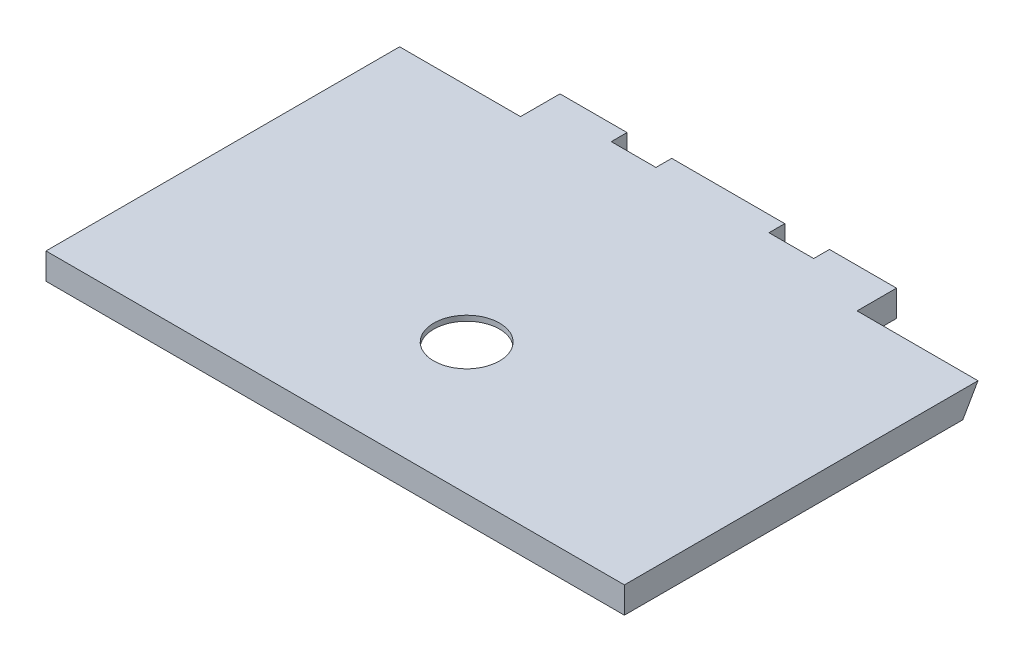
SolidWorks part; units mm, degrees
ref_plane "Front Plane" through (0, 0, 0) normal (0, 0, 1) x (1, 0, 0)
ref_plane "Top Plane" through (0, 0, 0) normal (0, 1, 0) x (1, 0, 0)
ref_plane "Right Plane" through (0, 0, 0) normal (1, 0, 0) x (0, 0, -1)
sketch "Sketch1" plane through (0, 0, 0) normal (0, 1, 0) x (1, 0, 0)
  line L0 (64, 99.5) -> (64, 84.5)
  line L1 (64, 84.5) -> (110, 84.5)
  line L2 (110, 84.5) -> (110, -50)
  line L3 (-64, 99.5) -> (64, 99.5)
  line L4 (110, -50) -> (-110, -50)
  line L5 (-110, -50) -> (-110, 84.5)
  line L6 (-110, 84.5) -> (-64, 84.5)
  line L7 (-64, 84.5) -> (-64, 99.5)
  circle A0 centre (0, 0) radius 12.5
  dimension "D1" = 25
  dimension "D2" = 110
  dimension "D4" = 110
  dimension "D6" = 99.5
  dimension "D3" = 128
  dimension "D5" = 15
  dimension "D7" = 149.5
extrude "Boss-Extrude1" add sketch "Sketch1" against normal blind 10
sketch "Sketch3" plane through (0, 0, 0) normal (0, 1, 0) x (1, 0, 0)
  line L0 (64, 99.5) -> (-64, 99.5) construction
  line L1 (-38.5, 99.5) -> (-21.5, 99.5)
  line L2 (-38.5, 99.5) -> (-38.5, 93.5)
  line L3 (-38.5, 93.5) -> (-21.5, 93.5)
  line L4 (-21.5, 99.5) -> (-21.5, 93.5)
  line L7 (21.5, 99.5) -> (38.5, 99.5)
  line L8 (21.5, 99.5) -> (21.5, 93.5)
  line L9 (21.5, 93.5) -> (38.5, 93.5)
  line L10 (38.5, 99.5) -> (38.5, 93.5)
  line L11 (-64, 99.5) -> (-64, 84.5) construction
  line L12 (64, 84.5) -> (64, 99.5) construction
  dimension "D1" = 17
  dimension "D2" = 6
  dimension "D3" = 25.5
  dimension "D4" = 25.5
extrude "Cut-Extrude2" cut sketch "Sketch3" against normal through all
sketch "Sketch4" plane through (110, 0, 0) normal (1, 0, 0) x (0, 0, -1)
  line L0 (84.5, 0) -> (78.7265, -10)
  line L1 (-50, -10) -> (84.5, -10) construction
  line L2 (78.7265, -10) -> (84.5, -10)
  line L3 (84.5, -10) -> (84.5, 0)
  dimension "D1" = 60
extrude "Cut-Extrude3" cut sketch "Sketch4" against normal up to surface (46 mm away)
sketch "Sketch5" plane through (-110, 0, 0) normal (-1, 0, 0) x (0, 0, 1)
  line L0 (-84.5, 0) -> (-84.5, -10)
  line L1 (-99.5, -10) -> (-84.5, -10) construction
  line L2 (-84.5, -10) -> (-84.5, 0) construction
  line L3 (-84.5, -10) -> (-78.7265, -10)
  line L4 (-84.5, -10) -> (50, -10) construction
  line L5 (-78.7265, -10) -> (-84.5, 0)
  dimension "D1" = 60
extrude "Cut-Extrude4" cut sketch "Sketch5" against normal up to surface (46 mm away)
hole_wizard "M4x0.7 Tapped Hole1" positions "Sketch7" profile "Sketch6" tap size "M4x0.7" standard "ANSI Metric"
sketch "Sketch7" plane through (0, -10, 0) normal (0, -1, 0) x (-1, 0, 0)
  point P0 (59, -24.0035)
  point P3 (59, 55.9965)
  point P6 (-59, -24.0035)
  point P9 (-59, 55.9965)
sketch "Sketch6" plane through (-59, -10, 24.0035) normal (1, 0, 0) x (0, 0, -1)
  line L0 (0, 0) -> (0, 9.4914)
  line L1 (0, 9.4914) -> (1.65, 8.5)
  line L2 (1.65, 8.5) -> (1.65, 0)
  line L5 (1.65, 0) -> (0, 0)
  line L10 (0, 9.4914) -> (-1.65, 8.5) construction
  line L11 (0, -6.35) -> (0, 107.95) construction
  dimension "Tap Drill Dia." = 3.3
  dimension "Tap Drill Depth" = 8.5
  dimension "Drill Angle" = 118
hole_wizard "M4x0.7 Tapped Hole2" positions "Sketch9" profile "Sketch8" tap size "M4x0.7" standard "ANSI Metric"
sketch "Sketch9" plane through (0, -10, 0) normal (0, -1, 0) x (-1, 0, 0)
  point P0 (0, 94.9965)
sketch "Sketch8" plane through (0, -10, -94.9965) normal (1, 0, 0) x (0, 0, -1)
  line L0 (0, 0) -> (0, 9.4914)
  line L1 (0, 9.4914) -> (1.65, 8.5)
  line L2 (1.65, 8.5) -> (1.65, 0)
  line L5 (1.65, 0) -> (0, 0)
  line L10 (0, 9.4914) -> (-1.65, 8.5) construction
  line L11 (0, -6.35) -> (0, 107.95) construction
  dimension "Tap Drill Dia." = 3.3
  dimension "Tap Drill Depth" = 8.5
  dimension "Drill Angle" = 118
sketch "Sketch10" plane through (0, -10, 0) normal (0, -1, 0) x (1, 0, 0)
  circle A0 centre (0, 0) radius 27.5
  dimension "D1" = 55
extrude "Cut-Extrude5" cut sketch "Sketch10" against normal blind 8
